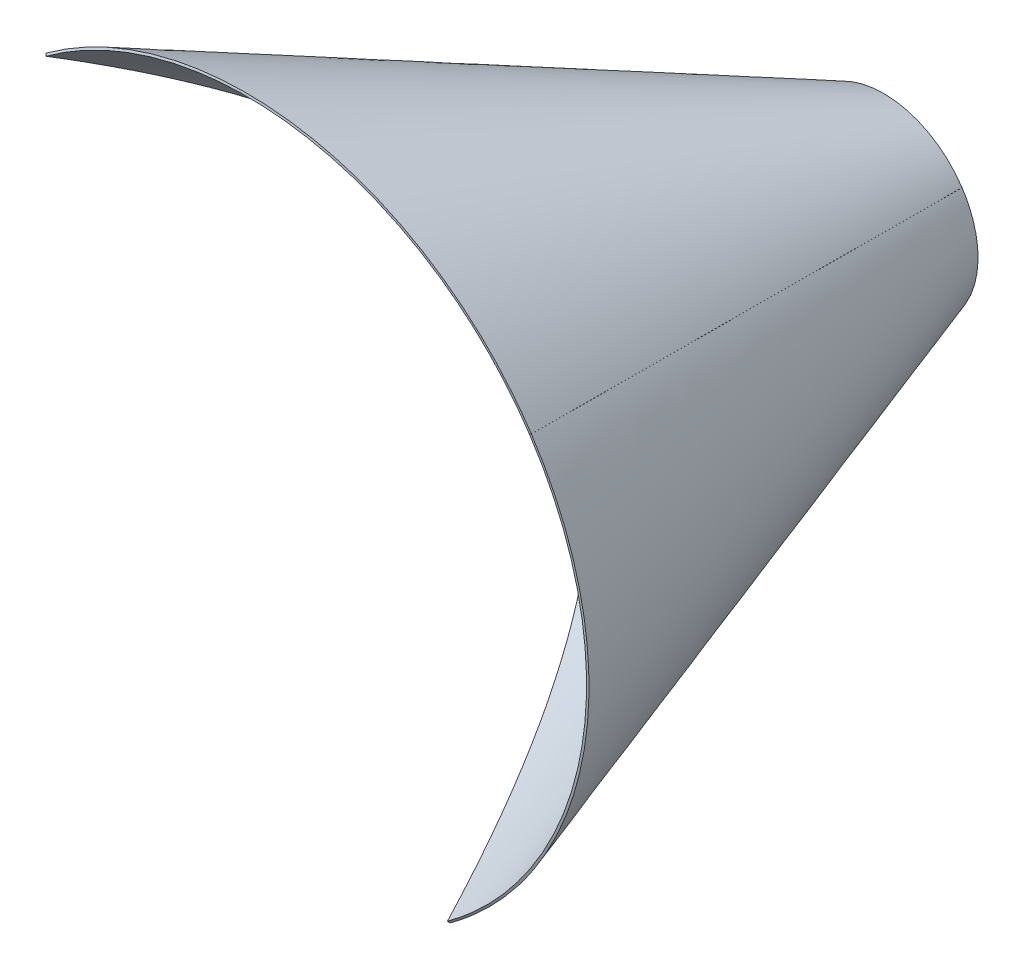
SolidWorks part; units mm, degrees
ref_plane "Ebene vorne" through (0, 0, 0) normal (0, 0, 1) x (1, 0, 0)
ref_plane "Ebene oben" through (0, 0, 0) normal (0, 1, 0) x (1, 0, 0)
ref_plane "Ebene rechts" through (0, 0, 0) normal (1, 0, 0) x (0, 0, -1)
sketch "Skizze1" plane through (0, 0, 0) normal (0, 0, 1) x (1, 0, 0)
  line L0 (0, 0) -> (375, 250) construction
  line L2 (0, 0) -> (499.2302, 332.8201) construction
  arc A0 (499.2302, 332.8201) -> (499.2856, 332.7369) centre (0, 0) ccw
  dimension "D1" = 1200
  dimension "D2" = 0.1
  dimension "D3" = 250
  dimension "D4" = 375
ref_plane "Ebene1" through (0, 0, -750) normal (0, 0, 1) x (1, 0, 0)
sketch "Skizze2" plane through (0, 0, -750) normal (0, 0, 1) x (1, 0, 0)
  line L0 (509.7921, 339.8614) -> (375, 250) construction
  line L2 (0, 0) -> (499.2302, 332.8201) construction
  arc A0 (509.7921, 339.8614) -> (509.8476, 339.7782) centre (375, 250) ccw
  dimension "D1" = 324
  dimension "D2" = 250
  dimension "D3" = 375
  dimension "D4" = 0.1
sheet metal parameters "Blech1" thickness 4 parameters "D1"=0.7366
lofted bend "Ausgeformte Biegungen1" thickness 4 parameters "D1"=0
other "Freiform-Biegung1" parameters "D1"=1000, "D4"=57.296, "D5"=1
sketch "Skizze4" plane through (-0.0681, -0.0498, -0.0038) normal (0.806, 0.5902, 0.0452) x (0.0365, 0.0267, -0.999)
  line L1 (-170.3371, -830.369) -> (900.3517, -830.369)
  line L2 (-170.3371, -830.369) -> (-170.3371, 953.3835)
  line L3 (-170.3371, 953.3835) -> (900.3517, 953.3835)
  line L4 (900.3517, -830.369) -> (900.3517, 953.3835)
extrude "Schnitt-Linear austragen3" cut sketch "Skizze4" against normal through all
flat pattern "Abwicklung1"
sketch "Biegung-Linien1" plane through (499.1745, 332.5938, 10.1522) normal (-0.8321, -0.5544, -0.0169) x (-0.0141, -0.0094, 0.9999)
  line L0 (-10.1537, 0.0578) -> (-760.2611, 0.0605) construction
  line L1 (-9.83, -254.1897) -> (-760.2493, -69.0502) construction
  line L2 (-14.2743, -505.5826) -> (-761.6647, -137.4715) construction
  line L3 (-38.1103, -755.8098) -> (-768.4853, -205.9208) construction
  line L4 (-230.1026, -862.4869) -> (-785.6103, -271.9819) construction
  line L5 (-513.5929, -780.7903) -> (-816.9454, -332.5546) construction
  line L6 (-691.9924, -749.5314) -> (-863.3684, -382.2868) construction
  line L7 (-826.5638, -751.7624) -> (-922.7137, -416.007) construction
  line L8 (-946.5143, -783.652) -> (-989.6219, -429.5553) construction
  line L9 (-1073.129, -851.2396) -> (-1057.4102, -421.5791) construction
  line L10 (-1234.1992, -974.686) -> (-1119.5242, -393.8273) construction
  line L11 (-1489.1019, -1206.202) -> (-1171.9599, -350.2217) construction
  line L12 (-1671.9909, -1086.9603) -> (-1213.446, -296.0345) construction
  line L13 (-1791.3897, -865.7689) -> (-1246.3764, -235.6405) construction
  line L14 (-1893.3862, -635.9556) -> (-1274.3236, -173.1706) construction
  line L15 (-1992.1082, -401.6531) -> (-1301.2288, -109.5113) construction
sketch3d "Rahmen1" [suppressed]
  line L0 (-1635.8036, -278.7286, 0) -> (331.8808, 183.703, 0) construction
  line L1 (-1392.559, -1313.7542, 0) -> (575.1254, -851.3227, 0) construction
  line L2 (-1635.8036, -278.7286, 0) -> (-1392.559, -1313.7542, 0) construction
  line L3 (331.8808, 183.703, 0) -> (575.1254, -851.3227, 0) construction
other "Abwickeln-<Freiform-Biegung1>1"
